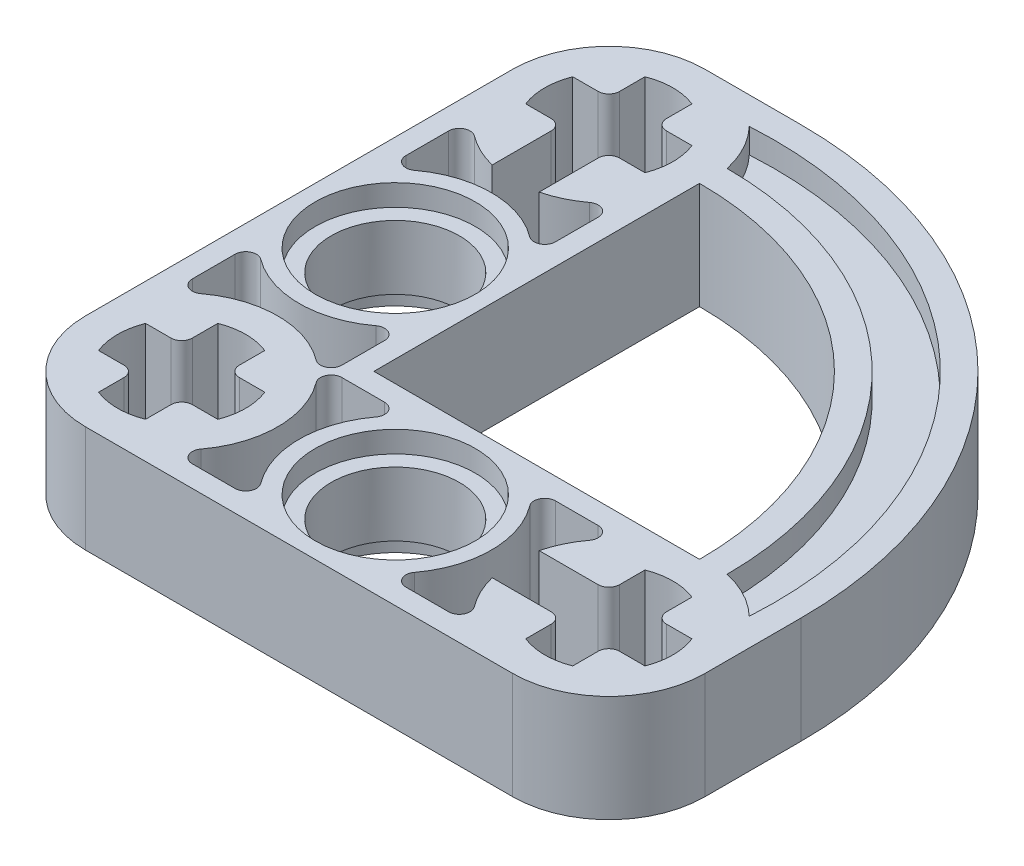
SolidWorks part; units mm, degrees
ref_plane "정면" through (0, 0, 0) normal (0, 0, 1) x (1, 0, 0)
ref_plane "윗면" through (0, 0, 0) normal (0, 1, 0) x (1, 0, 0)
ref_plane "우측면" through (0, 0, 0) normal (1, 0, 0) x (0, 0, -1)
ref_plane "평면1" through (0, 3.925, 0) normal (0, 1, 0) x (1, 0, 0)
sketch "스케치1" plane through (0, 3.925, 0) normal (0, 1, 0) x (1, 0, 0)
  line L0 (-4.345, -12.41) -> (-4.345, -0.2121)
  line L1 (7.8529, -12.41) -> (-4.345, -12.41)
  line L2 (-11.545, 3.59) -> (-11.545, -19.61)
  line L3 (-11.545, -19.61) -> (11.655, -19.61)
  line L4 (11.655, -19.61) -> (11.655, -12.41)
  line L5 (-4.345, 3.59) -> (-11.545, 3.59)
  arc A0 (-4.345, 3.59) -> (11.655, -12.41) centre (-4.345, -12.41) cw
  arc A1 (7.8529, -12.41) -> (-4.345, -0.2121) centre (-4.345, -12.41) ccw
  dimension "D1" = 23.2
  dimension "D2" = 7.2
  dimension "D3" = 12.1979
  dimension "D4" = 23.2
  dimension "D5" = 12.41
  dimension "D6" = 4.345
extrude "보스-돌출1" add sketch "스케치1" against normal blind 4
sketch "스케치2" plane through (0, 3.925, 0) normal (0, 1, 0) x (-1, 0, 0)
  line L0 (10.5853, 3.1942) -> (10.5853, 4.7742)
  line L1 (5.3047, 4.7742) -> (5.3047, 3.1942)
  line L2 (7.145, 3.6568) -> (7.145, 0.81)
  line L3 (7.145, 0.81) -> (5.545, 0.81)
  line L4 (5.545, -0.79) -> (7.145, -0.79)
  line L5 (7.145, -0.79) -> (7.145, -2.39)
  line L6 (8.745, -2.39) -> (8.745, -0.79)
  line L7 (8.745, -0.79) -> (10.345, -0.79)
  line L8 (10.345, 0.81) -> (8.745, 0.81)
  line L9 (8.745, 0.81) -> (8.745, 3.6568)
  line L10 (4.345, -3.59) -> (11.545, -3.59) construction
  line L11 (7.945, 8.065) -> (7.945, -2.8514) construction
  line L17 (11.545, -3.59) -> (11.545, 19.61) construction
  arc A0 (10.5853, 4.7742) -> (10.1621, 4.9546) centre (10.3353, 4.7742) ccw
  arc A1 (10.1621, 4.9546) -> (5.7279, 4.9546) centre (7.945, 8.065) cw
  arc A2 (5.7279, 4.9546) -> (5.3047, 4.7742) centre (5.5547, 4.7742) ccw
  arc A3 (5.3047, 3.1942) -> (5.7279, 3.0139) centre (5.5547, 3.1942) ccw
  arc A4 (5.7279, 3.0139) -> (7.145, 3.6568) centre (7.945, 0.01) cw
  arc A5 (5.545, 0.81) -> (5.545, -0.79) centre (7.945, 0.01) ccw
  arc A6 (7.145, -2.39) -> (8.745, -2.39) centre (7.945, 0.01) ccw
  arc A7 (10.345, -0.79) -> (10.345, 0.81) centre (7.945, 0.01) ccw
  arc A8 (8.745, 3.6568) -> (10.1621, 3.0139) centre (7.945, 0.01) cw
  arc A9 (10.1621, 3.0139) -> (10.5853, 3.1942) centre (10.3353, 3.1942) ccw
  point P30 (7.945, -3.59)
  dimension "D2" = 3.6
  dimension "D4" = 1.6
  dimension "D1" = 1.6
  dimension "D3" = 1.6
extrude "컷-돌출1" cut sketch "스케치2" against normal through all
sketch "스케치3" plane through (0, 3.925, 0) normal (0, 1, 0) x (-1, 0, 0)
  line L0 (-4.8261, 13.5602) -> (-3.2461, 13.5602)
  line L1 (-3.2461, 18.4598) -> (-4.8261, 18.4598)
  line L2 (-4.4394, 16.81) -> (-7.255, 16.81)
  line L3 (-7.255, 16.81) -> (-7.255, 18.2727)
  line L4 (-8.855, 18.2727) -> (-8.855, 16.81)
  line L5 (-8.855, 16.81) -> (-10.3177, 16.81)
  line L6 (-10.3177, 15.21) -> (-8.855, 15.21)
  line L7 (-8.855, 15.21) -> (-8.855, 13.7473)
  line L8 (-7.255, 13.7473) -> (-7.255, 15.21)
  line L9 (-7.255, 15.21) -> (-4.4394, 15.21)
  line L10 (0.01, 16.01) -> (-11.9544, 16.01) construction
  line L11 (-11.655, 19.61) -> (-11.655, 12.41) construction
  line L12 (11.545, 19.61) -> (-11.655, 19.61) construction
  line L13 (-8.055, 13.61) -> (-8.055, 20.0932) construction
  arc A0 (-3.2461, 13.5602) -> (-2.9961, 13.8102) centre (-3.2461, 13.8102) ccw
  arc A1 (-2.9961, 13.8102) -> (-2.9961, 18.2098) centre (0.01, 16.01) cw
  arc A2 (-2.9961, 18.2098) -> (-3.2461, 18.4598) centre (-3.2461, 18.2098) ccw
  arc A3 (-4.8261, 18.4598) -> (-5.0761, 18.2098) centre (-4.8261, 18.2098) ccw
  arc A4 (-5.0761, 18.2098) -> (-4.4394, 16.81) centre (-8.055, 16.01) cw
  arc A5 (-7.255, 18.2727) -> (-8.855, 18.2727) centre (-8.055, 16.01) ccw
  arc A6 (-10.3177, 16.81) -> (-10.3177, 15.21) centre (-8.055, 16.01) ccw
  arc A7 (-8.855, 13.7473) -> (-7.255, 13.7473) centre (-8.055, 16.01) ccw
  arc A8 (-4.4394, 15.21) -> (-5.0761, 13.8102) centre (-8.055, 16.01) cw
  arc A9 (-5.0761, 13.8102) -> (-4.8261, 13.5602) centre (-4.8261, 13.8102) ccw
  dimension "D4" = 2.4
  dimension "D1" = 3.6
  dimension "D2" = 3.6
  dimension "D3" = 1.6
  dimension "D5" = 1.6
extrude "컷-돌출2" cut sketch "스케치3" against normal through all
sketch "스케치4" plane through (0, 3.925, 0) normal (0, 1, 0) x (-1, 0, 0)
  line L0 (8.745, 13.7473) -> (8.745, 15.21)
  line L1 (8.745, 15.21) -> (10.2077, 15.21)
  line L2 (10.2077, 16.81) -> (8.745, 16.81)
  line L3 (8.745, 16.81) -> (8.745, 18.2727)
  line L4 (7.145, 18.2727) -> (7.145, 16.81)
  line L5 (7.145, 16.81) -> (5.6823, 16.81)
  line L6 (5.6823, 15.21) -> (7.145, 15.21)
  line L7 (7.145, 15.21) -> (7.145, 13.7473)
  line L8 (7.945, 19.61) -> (7.945, 12.2322) construction
  line L9 (11.545, 19.61) -> (-11.655, 19.61) construction
  line L10 (4.4446, 16.01) -> (11.1963, 16.01) construction
  arc A0 (10.2077, 15.21) -> (10.2077, 16.81) centre (7.945, 16.01) ccw
  arc A1 (8.745, 18.2727) -> (7.145, 18.2727) centre (7.945, 16.01) ccw
  arc A2 (5.6823, 16.81) -> (5.6823, 15.21) centre (7.945, 16.01) ccw
  arc A3 (7.145, 13.7473) -> (8.745, 13.7473) centre (7.945, 16.01) ccw
  arc A4 (-10.3177, 16.81) -> (-10.3177, 15.21) centre (-8.055, 16.01) ccw construction
  arc A5 (7.145, -2.39) -> (8.745, -2.39) centre (7.945, 0.01) ccw construction
  point P17 (-10.455, 16.01)
  point P22 (7.945, -2.5198)
  dimension "D1" = 2.4
  dimension "D2" = 1.6
  dimension "D3" = 1.6
extrude "컷-돌출3" cut sketch "스케치4" against normal through all
sketch "스케치5" plane through (0, 3.925, 0) normal (0, 1, 0) x (-1, 0, 0)
  line L0 (5.6052, 12.8875) -> (5.6052, 11.3075)
  line L1 (10.5248, 11.3075) -> (10.5248, 12.8875)
  arc A0 (5.8552, 13.1375) -> (5.6052, 12.8875) centre (5.8552, 12.8875) ccw
  arc A1 (5.6052, 11.3075) -> (5.8552, 11.0575) centre (5.8552, 11.3075) ccw
  arc A2 (5.8552, 11.0575) -> (10.2748, 11.0575) centre (8.065, 8.065) cw
  arc A3 (10.2748, 11.0575) -> (10.5248, 11.3075) centre (10.2748, 11.3075) ccw
  arc A4 (10.5248, 12.8875) -> (10.2748, 13.1375) centre (10.2748, 12.8875) ccw
  arc A5 (10.2748, 13.1375) -> (5.8552, 13.1375) centre (8.065, 16.13) cw
extrude "컷-돌출4" cut sketch "스케치5" against normal through all
sketch "스케치6" plane through (0, 3.925, 0) normal (0, 1, 0) x (-1, 0, 0)
  line L0 (4.8225, 18.5898) -> (3.2425, 18.5898)
  line L1 (3.2425, 13.6702) -> (4.8225, 13.6702)
  arc A0 (5.0725, 13.9202) -> (5.0725, 18.3398) centre (8.065, 16.13) cw
  arc A1 (5.0725, 18.3398) -> (4.8225, 18.5898) centre (4.8225, 18.3398) ccw
  arc A2 (3.2425, 18.5898) -> (2.9925, 18.3398) centre (3.2425, 18.3398) ccw
  arc A3 (2.9925, 18.3398) -> (2.9925, 13.9202) centre (0, 16.13) cw
  arc A4 (2.9925, 13.9202) -> (3.2425, 13.6702) centre (3.2425, 13.9202) ccw
  arc A5 (4.8225, 13.6702) -> (5.0725, 13.9202) centre (4.8225, 13.9202) ccw
extrude "컷-돌출5" cut sketch "스케치6" against normal blind 1
sketch "스케치9" plane through (0, -0.075, 0) normal (0, -1, 0) x (1, 0, 0)
  line L0 (-3.2425, 18.5898) -> (-4.8225, 18.5898)
  line L1 (-4.8225, 13.6702) -> (-3.2425, 13.6702)
  arc A0 (-4.8225, 18.5898) -> (-5.0725, 18.3398) centre (-4.8225, 18.3398) ccw
  arc A1 (-5.0725, 18.3398) -> (-5.0725, 13.9202) centre (-8.065, 16.13) cw
  arc A2 (-5.0725, 13.9202) -> (-4.8225, 13.6702) centre (-4.8225, 13.9202) ccw
  arc A3 (-3.2425, 13.6702) -> (-2.9925, 13.9202) centre (-3.2425, 13.9202) ccw
  arc A4 (-2.9925, 13.9202) -> (-2.9925, 18.3398) centre (0, 16.13) cw
  arc A5 (-2.9925, 18.3398) -> (-3.2425, 18.5898) centre (-3.2425, 18.3398) ccw
extrude "컷-돌출8" cut sketch "스케치9" against normal blind 1
ref_plane "평면2" through (0, 0, 16.13) normal (0, 0, -1) x (-1, 0, 0)
sketch "스케치14" plane through (0, 0, 16.13) normal (0, 0, -1) x (-1, 0, 0)
  line L0 (-3, -0.075) -> (0, -0.075)
  line L1 (0, -0.075) -> (0, 3.925)
  line L2 (0, 3.925) -> (-3, 3.925)
  line L3 (-3, 3.925) -> (-3, 3.525)
  line L4 (-3, 3.525) -> (-2.4, 3.525)
  line L5 (-2.4, 3.525) -> (-2.4, 0.325)
  line L6 (-2.4, 0.325) -> (-3, 0.325)
  line L7 (-3, 0.325) -> (-3, -0.075)
  line L8 (0, -0.075) -> (0, 3.925) construction
  line L9 (-11.655, -0.075) -> (4.345, -0.075) construction
  dimension "D1" = 2.4
  dimension "D2" = 4
  dimension "D3" = 3
  dimension "D4" = 0.4
  dimension "D5" = 0.4
revolve "컷-회전1" cut sketch "스케치14" angle 360 about L8
ref_plane "평면3" through (0, 0, 8.065) normal (0, 0, -1) x (-1, 0, 0)
ref_plane "평면4" through (0, 0, 0) normal (0, 0, -1) x (-1, 0, 0)
ref_plane "평면5" through (0, 0, 8.065) normal (0, 0, -1) x (-1, 0, 0)
sketch "스케치17" plane through (0, 0, 8.065) normal (0, 0, -1) x (-1, 0, 0)
  line L0 (5.065, -0.075) -> (8.065, -0.075)
  line L1 (8.065, -0.075) -> (8.065, 3.925)
  line L2 (8.065, 3.925) -> (5.065, 3.925)
  line L3 (5.065, 3.925) -> (5.065, 3.525)
  line L4 (5.065, 3.525) -> (5.665, 3.525)
  line L5 (5.665, 3.525) -> (5.665, 0.325)
  line L6 (5.665, 0.325) -> (5.065, 0.325)
  line L7 (5.065, 0.325) -> (5.065, -0.075)
  line L8 (8.065, -0.075) -> (8.065, 3.925) construction
  line L9 (5.8552, -0.075) -> (10.2748, -0.075) construction
  line L10 (4.345, -0.075) -> (11.545, -0.075) construction
  point P11 (8.065, -0.075)
  dimension "D1" = 3
  dimension "D2" = 4
  dimension "D3" = 0.4
  dimension "D4" = 0.4
  dimension "D5" = 2.4
revolve "컷-회전4" cut sketch "스케치17" angle 360 about L8
fillet "필렛1" radius 0.5 12 edges at (7.255, 1.925, 16.81) (-8.745, 1.925, 15.21) (-7.145, 1.925, 0.81) (8.855, 1.925, 16.81) (7.255, 1.925, 15.21) (-8.745, 1.925, -0.79) (-8.745, 1.925, 0.81) (-7.145, 1.925, -0.79) (-7.145, 1.925, 15.21) (-8.745, 1.925, 16.81) (-7.145, 1.925, 16.81) (8.855, 1.925, 15.21)
fillet "필렛2" radius 3.6 3 edges at (-11.545, 1.925, -3.59) (11.655, 1.925, 19.61) (-11.545, 1.925, 19.61)
sketch "스케치18" plane through (0, -0.075, 0) normal (0, -1, 0) x (1, 0, 0)
  arc A0 (8.852, 12.3764) -> (10.6302, 13.3254) centre (8.055, 16.01) ccw
  arc A1 (-5.2604, -2.5652) -> (-4.3114, -0.787) centre (-7.945, 0.01) ccw
  arc A2 (8.852, 12.3764) -> (-4.3114, -0.787) centre (-4.345, 12.41) cw
  arc A3 (10.6302, 13.3254) -> (-5.2604, -2.5652) centre (-4.345, 12.41) cw
  arc A5 (-4.345, 0.2121) -> (7.8529, 12.41) centre (-4.345, 12.41) ccw construction
  arc A6 (-4.345, -3.59) -> (11.655, 12.41) centre (-4.345, 12.41) ccw construction
  dimension "D1" = 7.44
  dimension "D2" = 7.44
  dimension "D3" = 0.9992
  dimension "D4" = 0.9969
extrude "컷-돌출13" cut sketch "스케치18" against normal blind 1
ref_plane "평면6" through (0, 1.9625, 0) normal (0, 1, 0) x (1, 0, 0)
mirror "대칭 복사1" about plane through (0, 1.9625, 0) normal (0, 1, 0) of "컷-돌출13"
sketch "Sketch1" plane through (0, 3.925, 0) normal (0, 1, 0) x (1, 0, 0)
  line L0 (-11.265, -0.01) -> (-11.265, -16.13)
  line L1 (-8.065, -19.33) -> (8.0497, -19.3553)
  line L2 (8.055, -12.6647) -> (-4.625, -12.6647)
  line L3 (-4.625, -12.6647) -> (-4.625, -0.01)
  arc A0 (-4.625, -0.01) -> (-11.265, -0.01) centre (-7.945, -0.01) ccw
  arc A1 (-11.265, -16.13) -> (-8.065, -19.33) centre (-8.065, -16.13) ccw
  arc A2 (8.0497, -19.3553) -> (8.055, -12.6647) centre (8.055, -16.01) ccw
extrude "Boss-Extrude1" add sketch "Sketch1" against normal up to surface (4 mm away)
sketch "Sketch2" plane through (0, 3.925, 0) normal (0, 1, 0) x (1, 0, 0)
  line L0 (-8.825, 2.2228) -> (-8.825, 1.27)
  line L1 (-7.065, -2.2428) -> (-7.065, -1.29)
  line L2 (-5.7122, 0.87) -> (-6.665, 0.87)
  line L3 (-10.1778, -0.89) -> (-9.225, -0.89)
  line L4 (-8.825, -1.29) -> (-8.825, -2.2428)
  line L5 (-9.225, 0.87) -> (-10.1778, 0.87)
  line L6 (-7.065, 1.27) -> (-7.065, 2.2228)
  line L7 (-6.665, -0.89) -> (-5.7122, -0.89)
  line L8 (-8.825, -13.7772) -> (-8.825, -14.73)
  line L9 (-8.825, -17.29) -> (-8.825, -18.2428)
  line L10 (-7.065, -18.2428) -> (-7.065, -17.29)
  line L11 (-5.7122, -15.13) -> (-6.665, -15.13)
  line L12 (-10.1778, -16.89) -> (-9.225, -16.89)
  line L13 (-9.225, -15.13) -> (-10.1778, -15.13)
  line L14 (-7.065, -14.73) -> (-7.065, -13.7772)
  line L15 (-6.665, -16.89) -> (-5.7122, -16.89)
  line L24 (-10.745, -3.21) -> (-10.745, -4.81)
  line L25 (-5.145, -3.21) -> (-5.145, -4.81)
  line L26 (-11.545, -0.01) -> (-11.545, -16.01) construction
  line L27 (-4.345, -0.2121) -> (-4.345, -12.41) construction
  line L28 (-10.745, -11.21) -> (-10.745, -12.81)
  line L29 (-5.145, -11.21) -> (-5.145, -12.81)
  line L30 (-8.825, -2.2428) -> (-8.825, -3.5008)
  line L31 (-7.065, -2.2428) -> (-7.065, -3.5008)
  line L32 (10.2878, -15.13) -> (9.335, -15.13)
  line L33 (5.8222, -16.89) -> (6.775, -16.89)
  line L34 (8.935, -18.2428) -> (8.935, -17.29)
  line L35 (7.175, -13.7772) -> (7.175, -14.73)
  line L36 (6.775, -15.13) -> (5.8222, -15.13)
  line L37 (8.935, -14.73) -> (8.935, -13.7772)
  line L38 (9.335, -16.89) -> (10.2878, -16.89)
  line L39 (7.175, -17.29) -> (7.175, -18.2428)
  line L40 (4.855, -13.21) -> (3.255, -13.21)
  line L41 (4.855, -18.81) -> (3.255, -18.81)
  line L42 (-3.145, -13.21) -> (-4.745, -13.21)
  line L43 (-3.145, -18.81) -> (-4.745, -18.81)
  line L44 (5.8222, -15.13) -> (4.5642, -15.13)
  line L45 (5.8222, -16.89) -> (4.5642, -16.89)
  arc A0 (-5.7122, -16.89) -> (-5.7122, -15.13) centre (-7.945, -16.01) ccw
  arc A3 (-10.1778, 0.87) -> (-10.1778, -0.89) centre (-7.945, -0.01) ccw
  circle A4 centre (-7.945, -8.01) radius 2.4
  arc A5 (-7.065, 2.2228) -> (-8.825, 2.2228) centre (-7.945, -0.01) ccw
  arc A6 (-5.7122, -0.89) -> (-5.7122, 0.87) centre (-7.945, -0.01) ccw
  arc A8 (-7.065, -1.29) -> (-6.665, -0.89) centre (-6.665, -1.29) cw
  arc A9 (-8.825, -1.29) -> (-9.225, -0.89) centre (-9.225, -1.29) ccw
  arc A10 (-6.665, 0.87) -> (-7.065, 1.27) centre (-6.665, 1.27) cw
  arc A11 (-8.825, 1.27) -> (-9.225, 0.87) centre (-9.225, 1.27) cw
  arc A12 (-7.065, -13.7772) -> (-8.825, -13.7772) centre (-7.945, -16.01) ccw
  arc A13 (-10.1778, -15.13) -> (-10.1778, -16.89) centre (-7.945, -16.01) ccw
  arc A14 (-8.825, -18.2428) -> (-7.065, -18.2428) centre (-7.945, -16.01) ccw
  arc A15 (-8.825, -17.29) -> (-9.225, -16.89) centre (-9.225, -17.29) ccw
  arc A16 (-7.065, -17.29) -> (-6.665, -16.89) centre (-6.665, -17.29) cw
  arc A17 (-6.665, -15.13) -> (-7.065, -14.73) centre (-6.665, -14.73) cw
  arc A18 (-8.825, -14.73) -> (-9.225, -15.13) centre (-9.225, -14.73) cw
  arc A26 (-10.105, -2.89) -> (-8.825, -3.5008) centre (-7.945, -0.01) ccw
  arc A27 (-10.105, -10.89) -> (-5.785, -10.89) centre (-7.945, -8.01) ccw
  arc A28 (-5.785, -13.13) -> (-10.105, -13.13) centre (-7.945, -16.01) ccw
  arc A29 (-5.785, -5.13) -> (-10.105, -5.13) centre (-7.945, -8.01) ccw
  arc A30 (-10.105, -10.89) -> (-10.745, -11.21) centre (-10.345, -11.21) ccw
  arc A31 (-10.105, -13.13) -> (-10.745, -12.81) centre (-10.345, -12.81) cw
  arc A32 (-5.785, -13.13) -> (-5.145, -12.81) centre (-5.545, -12.81) ccw
  arc A33 (-5.785, -10.89) -> (-5.145, -11.21) centre (-5.545, -11.21) cw
  arc A34 (-5.785, -2.89) -> (-5.145, -3.21) centre (-5.545, -3.21) cw
  arc A35 (-5.785, -5.13) -> (-5.145, -4.81) centre (-5.545, -4.81) ccw
  arc A36 (-10.105, -5.13) -> (-10.745, -4.81) centre (-10.345, -4.81) cw
  arc A37 (-10.105, -2.89) -> (-10.745, -3.21) centre (-10.345, -3.21) ccw
  arc A38 (-7.065, -3.5008) -> (-5.785, -2.89) centre (-7.945, -0.01) ccw
  arc A39 (8.935, -13.7772) -> (7.175, -13.7772) centre (8.055, -16.01) ccw
  circle A40 centre (0.055, -16.01) radius 2.4
  arc A41 (10.2878, -16.89) -> (10.2878, -15.13) centre (8.055, -16.01) ccw
  arc A42 (7.175, -18.2428) -> (8.935, -18.2428) centre (8.055, -16.01) ccw
  arc A43 (6.775, -16.89) -> (7.175, -17.29) centre (6.775, -17.29) cw
  arc A44 (6.775, -15.13) -> (7.175, -14.73) centre (6.775, -14.73) ccw
  arc A45 (8.935, -17.29) -> (9.335, -16.89) centre (9.335, -17.29) cw
  arc A46 (9.335, -15.13) -> (8.935, -14.73) centre (9.335, -14.73) cw
  arc A47 (5.175, -13.85) -> (4.5642, -15.13) centre (8.055, -16.01) ccw
  arc A48 (-2.825, -13.85) -> (-2.825, -18.17) centre (0.055, -16.01) ccw
  arc A49 (-5.065, -18.17) -> (-5.065, -13.85) centre (-7.945, -16.01) ccw
  arc A50 (2.935, -18.17) -> (2.935, -13.85) centre (0.055, -16.01) ccw
  arc A51 (-2.825, -13.85) -> (-3.145, -13.21) centre (-3.145, -13.61) ccw
  arc A52 (-5.065, -13.85) -> (-4.745, -13.21) centre (-4.745, -13.61) cw
  arc A53 (-5.065, -18.17) -> (-4.745, -18.81) centre (-4.745, -18.41) ccw
  arc A54 (-2.825, -18.17) -> (-3.145, -18.81) centre (-3.145, -18.41) cw
  arc A55 (5.175, -18.17) -> (4.855, -18.81) centre (4.855, -18.41) cw
  arc A56 (2.935, -18.17) -> (3.255, -18.81) centre (3.255, -18.41) ccw
  arc A57 (2.935, -13.85) -> (3.255, -13.21) centre (3.255, -13.61) cw
  arc A58 (5.175, -13.85) -> (4.855, -13.21) centre (4.855, -13.61) ccw
  arc A59 (4.5642, -16.89) -> (5.175, -18.17) centre (8.055, -16.01) ccw
  point P26 (-7.065, -0.89)
  point P31 (-7.065, 0.87)
  point P34 (-8.825, 0.87)
  point P50 (-7.065, -16.89)
  point P53 (-7.065, -15.13)
  point P56 (-8.825, -15.13)
  point P83 (-10.745, -10.2727)
  point P98 (-5.145, -10.2727)
  point P136 (-7.945, -16.01)
  dimension "D1" = 4.8
  dimension "D3" = 2
  dimension "D6" = 4.8
  dimension "D7" = 4.8
  dimension "D8" = 8
  dimension "D9" = 8
  dimension "D10" = 0.4
  dimension "D18" = 0.4
  dimension "D24" = 0.4
  dimension "D11" = 1.76
  dimension "D12" = 0.88
  dimension "D13" = 1.76
  dimension "D14" = 0.88
  dimension "D15" = 1.76
  dimension "D16" = 0.88
  dimension "D17" = 1.76
  dimension "D22" = 0.8
  dimension "D23" = 0.8
extrude "Cut-Extrude1" cut sketch "Sketch2" against normal through all
sketch "Sketch4" plane through (0, 3.925, 0) normal (0, 1, 0) x (1, 0, 0)
  circle A0 centre (-7.945, -8.01) radius 3
  circle A1 centre (0.055, -16.01) radius 3
extrude "Cut-Extrude2" cut sketch "Sketch4" against normal blind 0.8
sketch "Sketch5" plane through (0, -0.075, 0) normal (0, -1, 0) x (1, 0, 0)
  circle A0 centre (-7.945, 8.01) radius 3
  circle A1 centre (0.055, 16.01) radius 3
extrude "Cut-Extrude3" cut sketch "Sketch5" against normal blind 0.8
